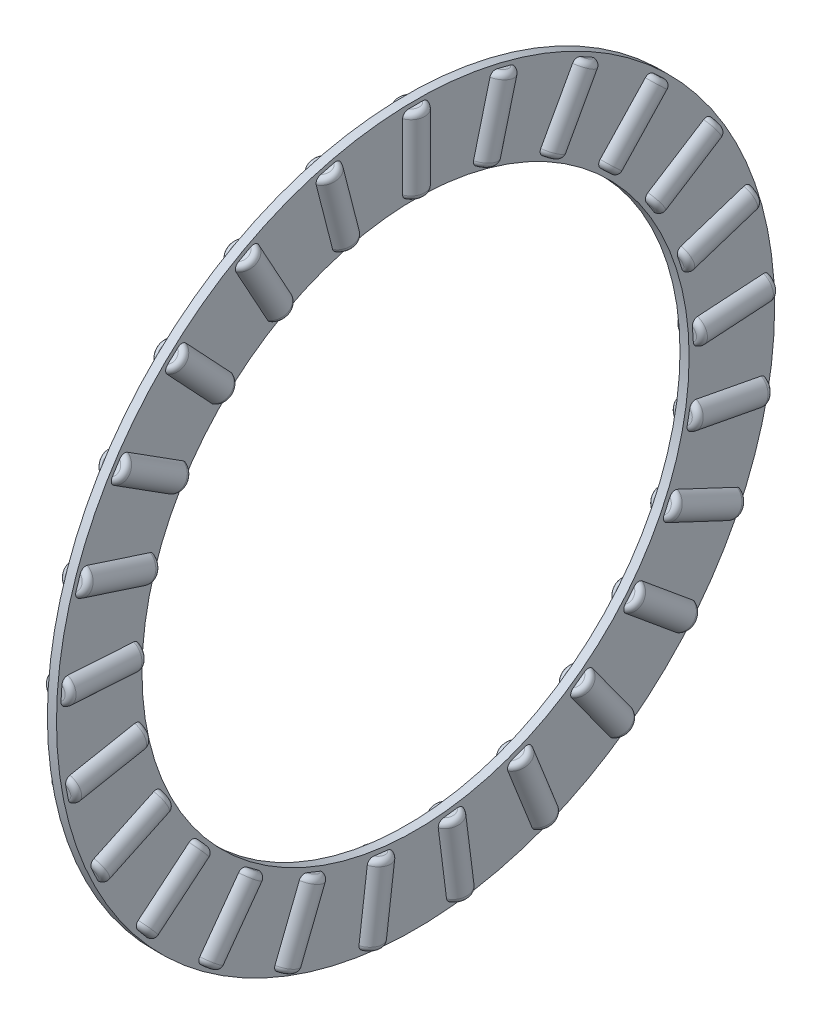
SolidWorks part; units mm, degrees
ref_plane "Plane1" through (0, 0, 0) normal (0, 0, 1) x (1, 0, 0)
ref_plane "Plane2" through (0, 0, 0) normal (0, 1, 0) x (1, 0, 0)
ref_plane "Plane3" through (0, 0, 0) normal (1, 0, 0) x (0, 0, -1)
other "Configuration Table"
sketch "Clipboard" plane through (0, 0, 0) normal (0, 0, 1) x (1, 0, 0)
  line L0 (-10, 0) -> (10, 0) construction
  line L1 (0, 0) -> (20.2657, -9.45)
  line L2 (0, 0) -> (41.9167, 19.5461)
  line L3 (0, 0) -> (20.2657, -9.45)
  line L4 (0, 0) -> (-22.3471, -0.7804)
sketch "CagSpiSke" plane through (0, 0, 0) normal (0, 0, 1) x (1, 0, 0)
  line L5 (-34.925, 0) -> (34.925, 0) construction
  line L6 (-0.6667, 52.5) -> (0.6667, 52.5)
  line L7 (-0.6667, 52.5) -> (-0.6667, 40)
  line L8 (-0.6667, 40) -> (0.6667, 40)
  line L9 (0.6667, 52.5) -> (0.6667, 40)
revolve "CageSpine" add sketch "CagSpiSke" angle 360 about L5
ref_axis "Axis1" through (-50, 0, 0) along (1, 0, 0)
sketch "RolDetSke" plane through (0, 0, 0) normal (0, 0, 1) x (1, 0, 0)
  line L0 (0, 33.02) -> (0, 55.88) construction
  line L3 (0, 51.875) -> (1.2, 51.875)
  line L4 (0, 51.875) -> (0, 40.625)
  line L5 (0, 40.625) -> (1.2, 40.625)
  line L6 (2, 51.075) -> (2, 41.425)
  arc A0 (2, 41.425) -> (1.2, 40.625) centre (1.2, 41.425) cw
  arc A1 (1.2, 51.875) -> (2, 51.075) centre (1.2, 51.075) cw
revolve "RollerDetailed" add sketch "RolDetSke" angle 360 about L0
pattern_circular "RollersDetailed" count 25 every 14.4 about axis through (-50, 0, 0) along (1, 0, 0) of "RollerDetailed"
sketch "RolSimSke" plane through (0, 0, 0) normal (0, 0, 1) x (1, 0, 0)
  line L1 (-17.78, 0) -> (12.7, 0) construction
  line L3 (-1.2, 51.875) -> (1.2, 51.875)
  line L4 (-2, 51.075) -> (-2, 41.425)
  line L5 (-1.2, 40.625) -> (1.2, 40.625)
  line L6 (2, 51.075) -> (2, 41.425)
  arc A0 (-2, 41.425) -> (-1.2, 40.625) centre (-1.2, 41.425) ccw
  arc A1 (-1.2, 51.875) -> (-2, 51.075) centre (-1.2, 51.075) ccw
  arc A2 (2, 51.075) -> (1.2, 51.875) centre (1.2, 51.075) ccw
  arc A3 (1.2, 40.625) -> (2, 41.425) centre (1.2, 41.425) ccw
revolve "RollersSimplified" [suppressed] add sketch "RolSimSke" angle 360 about L1
equation "\"BallCLRad@Clipboard\" =  ( \"OD@CagSpiSke\" + \"ID@CagSpiSke\" )  / 4"
equation "\"offset@RolSimSke\" = \"BallCLRad@Clipboard\" - \"Cyl_Len@RolSimSke\" / 2"
equation "\"offset@RolDetSke\" = \"BallCLRad@Clipboard\" - \"Cyl_Len@RolDetSke\" / 2"
equation "\"Thickness@CagSpiSke\" =  \"Roller_diameter@RolDetSke\" / 3"
equation "\"HalfThick@CagSpiSke\" = \"Thickness@CagSpiSke\" / 2"
equation "\"radius@RolDetSke\" =  ( \"Roller_diameter@RolDetSke\" - \"Thickness@CagSpiSke\" )  * 0.6 / 2"
equation "\"Roller_diameter@RolSimSke\" = \"Roller_diameter@RolDetSke\""
equation "\"Cyl_Len@RolSimSke\" = \"Cyl_Len@RolDetSke\""
equation "\"Rol_rad@RolSimSke\" = \"radius@RolDetSke\""
equation "\"Halfdia@RolSimSke\" = \"Roller_diameter@RolSimSke\" / 2"
equation "\"Max_count@Clipboard\" = int( 3.14159265 / atn(( \"Roller_diameter@RolDetSke\" / 2) / sqr( \"offset@RolDetSke\"  *  \"offset@RolDetSke\" - ( \"Roller_diameter@RolDetSke\" / 2) *  ( \"Roller_diameter@RolDetSke\" "
equation "\"Max_count@Clipboard\" = ((sgn( \"Max_count@Clipboard\" - \"Count@Clipboard\" )-1)*( \"Max_count@Clipboard\" - \"Count@Clipboard\" ))/-2+ \"Count@Clipboard\""
equation "\"Count@RollersDetailed\" = int( \"Show_count@Clipboard\" ) "
equation "\"Count@RollersDetailed\" = ((sgn( \"Count@RollersDetailed\" - \"Max_count@Clipboard\" )-1)*( \"Count@RollersDetailed\" - \"Max_count@Clipboard\" ))/-2+ \"Max_count@Clipboard\""
equation "\"Count@RollersDetailed\" = ((sgn( \"Count@RollersDetailed\" - \"Min_count@Clipboard\" )+1)*( \"Count@RollersDetailed\" - \"Min_count@Clipboard\"))/2 +\"Min_count@Clipboard\""
equation "\"Angle@RollersDetailed\" = 360.0 / \"Max_count@Clipboard\""
